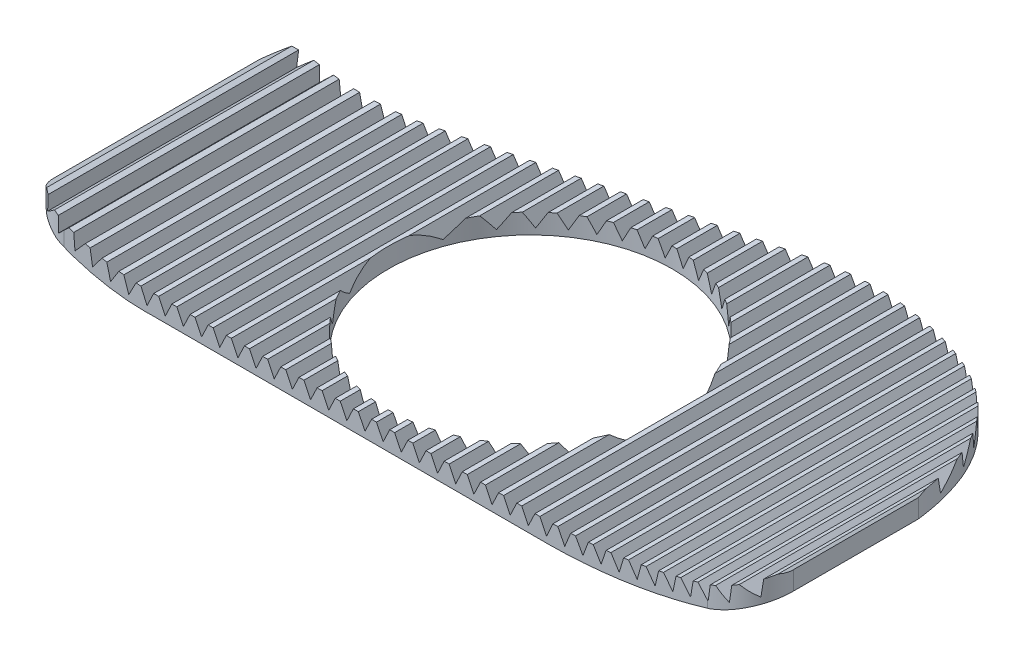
SolidWorks part; units mm, degrees
ref_plane "Front Plane" through (0, 0, 0) normal (0, 0, 1) x (1, 0, 0)
ref_plane "Top Plane" through (0, 0, 0) normal (0, 1, 0) x (1, 0, 0)
ref_plane "Right Plane" through (0, 0, 0) normal (1, 0, 0) x (0, 0, -1)
sketch "Sketch1" plane through (0, 0, 0) normal (0, 0, 1) x (1, 0, 0)
  line L0 (118, 3) -> (40, 3) construction
  line L1 (160, 3) -> (147, 3) construction
  line L2 (147, 3) -> (40, 3)
  line L3 (160, 3) -> (147, 3)
  arc A0 (14.5824, 7.9884) -> (40, 3) centre (40, 70.25) ccw construction
  arc A1 (1.7082, 14.9662) -> (14.5824, 7.9884) centre (40, 70.25) ccw construction
  arc A2 (160, 3) -> (209.8567, 10.3732) centre (160, 175.25) ccw construction
  arc A3 (209.8567, 10.3732) -> (223.8873, 15.286) centre (160, 175.25) ccw construction
  arc A4 (14.5824, 7.9884) -> (40, 3) centre (40, 70.25) ccw
  arc A5 (1.7082, 14.9662) -> (14.5824, 7.9884) centre (40, 70.25) ccw
  arc A6 (160, 3) -> (209.8567, 10.3732) centre (160, 175.25) ccw
  arc A7 (209.8567, 10.3732) -> (223.8873, 15.286) centre (160, 175.25) ccw
curve "CompCurve1"
sketch "Sketch2" plane through (0, 0, 0) normal (0, 0, 1) x (1, 0, 0)
  line L0 (40, 3) -> (46, 3)
  line L1 (43, 3) -> (43, 9) construction
  line L2 (40, 3) -> (40, 4.3)
  line L3 (46, 3) -> (46, 4.3)
  line L4 (40, 4.3) -> (42.25, 9)
  line L5 (46, 4.3) -> (43.75, 9)
  line L6 (42.25, 9) -> (43.75, 9)
  dimension "D1" = 6
  dimension "D2" = 1.3
  dimension "D3" = 6
  dimension "D4" = 1.5
extrude "Boss-Extrude1" add sketch "Sketch2" against normal blind 130
pattern_curve "CrvPattern1" of "Boss-Extrude1" parameters "D1"=34, "D3"=5.5, "D2"=1, "D4"=10
pattern_curve "CrvPattern2" of "Boss-Extrude1" parameters "D1"=9, "D3"=5.5, "D2"=1, "D4"=10
sketch "Sketch3" plane through (0, 0, 0) normal (0, -1, 0) x (1, 0, 0)
  circle A2 centre (108.3533, -50) radius 43
  circle A3 centre (108.3533, -50) radius 43
  dimension "D1" = 5
extrude "Cut-Extrude1" cut sketch "Sketch3" against normal through all
sketch "Sketch5" plane through (0, 0, 0) normal (0, -1, 0) x (1, 0, 0)
  line L2 (66.4746, -94.4611) -> (40.4824, -88.0009)
  line L3 (94.6184, -101.4561) -> (11.8791, -80.8917)
  line L5 (2, -68.2565) -> (2, -15)
  line L6 (2, -68.2565) -> (2, -15)
  line L8 (40, -2) -> (147, -2)
  line L9 (15, -2) -> (210, -2)
  line L13 (132.3919, -110.8446) -> (94.6184, -101.4561)
  line L14 (223, -52.8711) -> (223, -15)
  line L15 (223, -52.8711) -> (223, -15)
  line L16 (132.3919, -110.8446) -> (94.6184, -101.4561)
  arc A0 (11.8791, -80.8917) -> (2, -68.2565) centre (15.0195, -68.2565) cw
  arc A1 (132.3919, -110.8446) -> (223, -52.8711) centre (150.2558, -38.9709) ccw
  arc A2 (210, -2) -> (223, -15) centre (210, -15) cw
  arc A3 (2, -15) -> (15, -2) centre (15, -15) cw
  dimension "D4" = 2
  dimension "D1" = 2
  dimension "D2" = 2
  dimension "D3" = 2
  dimension "D5" = 2
extrude "Cut-Extrude4" cut sketch "Sketch5" against normal through all flip side to cut
